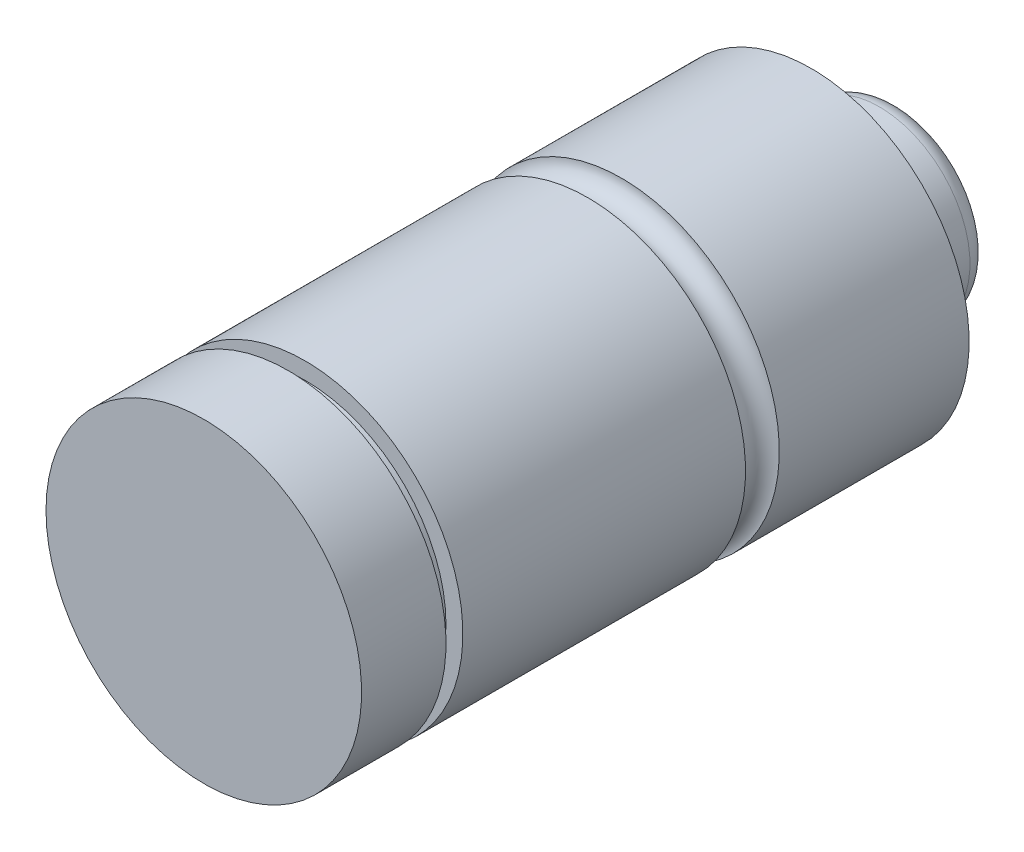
SolidWorks part; units mm, degrees
ref_plane "Front" through (0, 0, 0) normal (0, 0, 1) x (1, 0, 0)
ref_plane "Top" through (0, 0, 0) normal (0, 1, 0) x (1, 0, 0)
ref_plane "Right" through (0, 0, 0) normal (1, 0, 0) x (0, 0, -1)
sketch "Logo3_Revol_Axis" plane through (0, 0, 0) normal (0, 1, 0) x (1, 0, 0)
  line L0 (0, -30.1653) -> (0, 30.1653) construction
sketch "Logo3_bib1" plane through (0, 0, 0) normal (0, -1, 0) x (-1, 0, 0)
  line L0 (0, 41.859) -> (0, 0)
  line L1 (0, 0) -> (9.4996, 0)
  line L2 (9.4996, 0) -> (9.4996, 5.08)
  line L3 (5.461, 36.576) -> (9.4996, 36.576)
  line L4 (5.461, 36.576) -> (5.461, 40.6652)
  line L5 (4.2672, 41.859) -> (0, 41.859)
  line L6 (9.4996, 5.08) -> (8.4836, 5.08)
  line L7 (8.4836, 5.08) -> (8.4836, 6.096)
  line L8 (8.4836, 6.096) -> (9.4996, 6.096)
  line L9 (9.4996, 6.096) -> (9.4996, 23.114)
  line L10 (0, 88.0738) -> (0, -34.1764) construction
  line L11 (7.6151, 24.13) -> (28.8972, 24.13) construction
  line L12 (8.4836, 52.4707) -> (8.4836, 42.083) construction
  line L13 (9.4996, 25.146) -> (9.4996, 36.576)
  line L14 (0, 34.747) -> (5.461, 34.747) construction
  arc A0 (9.4996, 25.146) -> (9.4996, 23.114) centre (9.4996, 24.13) ccw
  arc A1 (5.461, 40.6652) -> (4.2672, 41.859) centre (4.2672, 40.6652) ccw
  dimension "logo3_r2b" = 1.016
  dimension "logo3_r0" = 1.1938
  dimension "logo3_d1" = 18.9992
  dimension "logo3_l1" = 41.859
  dimension "logo3_l0" = 36.576
  dimension "logo3_d0" = 10.922
  dimension "logo3_l2" = 12.446
  dimension "logo3_r2" = 8.4836
  dimension "logo3_r3" = 8.4836
  dimension "logo3_l3" = 5.08
  dimension "logo3_th3" = 1.016
  dimension "logo3_fleche" = 7.112
revolve "Revolve1" add sketch "Logo3_bib1" angle 360 about L10
